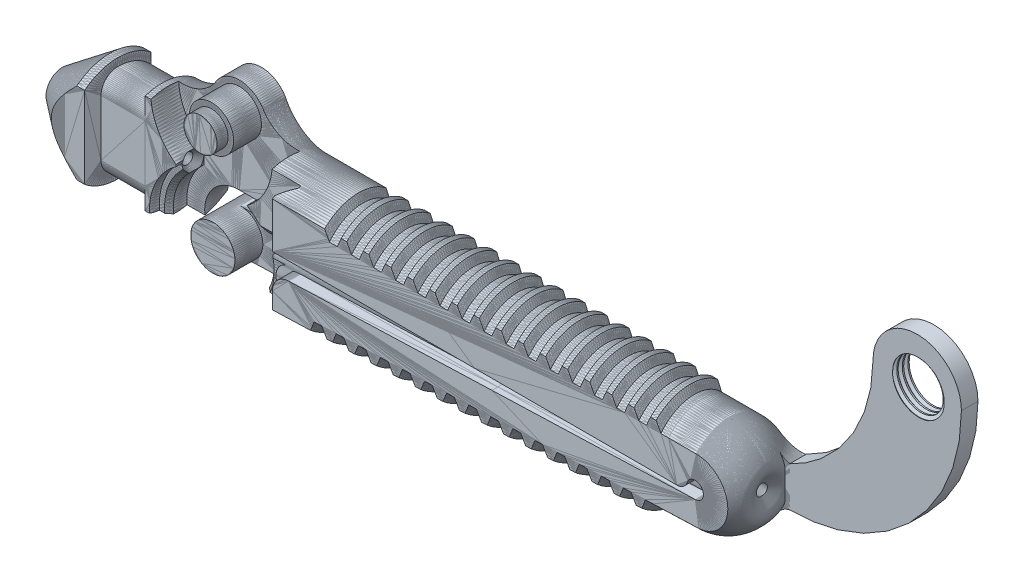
SolidWorks part; units mm, degrees
ref_plane "Front Plane" through (0, 0, 0) normal (0, 0, 1) x (1, 0, 0)
ref_plane "Top Plane" through (0, 0, 0) normal (0, 1, 0) x (1, 0, 0)
ref_plane "Right Plane" through (0, 0, 0) normal (1, 0, 0) x (0, 0, -1)
imported_body "Imported1"
sketch "Sketch1" plane through (0, 0, 0) normal (0, 0, 1) x (1, 0, 0)
  line L1 (144.0528, 112.3031) -> (178.4911, 112.3031)
  line L2 (144.0528, 112.3031) -> (144.0528, 73.8316)
  line L3 (144.0528, 73.8316) -> (178.4911, 73.8316)
  line L4 (178.4911, 112.3031) -> (178.4911, 73.8316)
extrude "Cut-Extrude1" cut sketch "Sketch1" against normal through all and the other way through all
sketch "Sketch2" plane through (0, 0, 0) normal (0, 0, 1) x (1, 0, 0)
  line L1 (135.9411, 85.8268) -> (211.3676, 85.8268) construction
  line L5 (144.0528, 89.4694) -> (144.0528, 82.2365)
  arc A0 (175.1431, 113.3268) -> (159.1431, 113.3268) centre (167.1431, 113.3268) ccw
  circle A1 centre (167.1431, 113.3268) radius 27.5 construction
  circle A2 centre (135.9411, 85.8268) radius 1.5004 construction
  arc A3 (144.0528, 82.2365) -> (175.1431, 113.3268) centre (144.0528, 113.3268) ccw
  arc A4 (144.0528, 89.4694) -> (159.1431, 113.3268) centre (132.7389, 113.3268) ccw
  dimension "D1" = 16
  dimension "D2" = 55
extrude "Boss-Extrude2" add sketch "Sketch2" along normal up to surface (3.0011 mm away)
sketch "Sketch6" plane through (-0.0001, 0.0002, 3.0041) normal (0, 0.0001, 1) x (1, 0, 0)
  line L0 (167.1432, 113.3264) -> (167.1429, 113.3272) construction
  circle A0 centre (167.1431, 113.3266) radius 4.45
  ellipse E0 centre (167.1431, 113.3266) end of major axis (164.6337, 120.9228) minor radius 8 (175.1431, 113.3266) -> (159.1431, 113.3266) ccw construction
  dimension "D1" = 8.9
extrude "Cut-Extrude2" cut sketch "Sketch6" against normal blind 10
thread "Thread1" pitch 1 start angle 0, offset 5, length 10, pitch 1, diameter 8.9
ref_plane "Plane2" through (162.6929, 113.3271, 7.9999) normal (0, -1, 0.0001) x (-1, 0, 0)
sketch "Thread Profile1" plane through (162.6929, 113.3271, 7.9999) normal (0, -1, 0.0001) x (-1, 0, 0)
  line L0 (0, 0) -> (0, 1) construction
  line L1 (0, 0) -> (0.5413, 0.3125)
  line L2 (0.5413, 0.3125) -> (0.5413, 0.4375)
  line L3 (0.5413, 0.4375) -> (0, 0.75)
  line L4 (0.5413, 0.375) -> (0, 0.375) construction
  line L11 (0, 0) -> (0, 0.75)
  point P2 (0, 0)
  dimension "Pitch" = 1
  dimension "Profile_Angle" = 60
  dimension "Profile_Land" = 0.125
  dimension "Profile_Height" = 0.5413
sketch "Sketch3" plane through (-0.0001, 0.0002, 3.0041) normal (0, 0.0001, 1) x (1, 0, 0)
  line L0 (165.6432, 113.3264) -> (165.6429, 113.3273) construction
  circle A0 centre (165.6431, 113.3266) radius 9.5
  circle A1 centre (165.6431, 113.3266) radius 6
  ellipse E1 centre (165.6431, 113.3266) end of major axis (162.6632, 122.3471) minor radius 9.5 (175.1431, 113.3266) -> (156.1431, 113.3266) ccw construction
  dimension "D1" = 19
  dimension "D2" = 12
extrude "Boss-Extrude3" add sketch "Sketch3" along normal blind 32
ref_plane "Plane1" through (165.6431, 0, 0.0039) normal (-1, 0, 0) x (0, -0.0001, -1)
sketch "Sketch5" plane through (165.6431, 0, 0.0039) normal (-1, 0, 0) x (0, -0.0001, -1)
  line L0 (-3.0041, -103.8266) -> (-35.0041, -103.8266) construction
  line L1 (-34.0041, -103.8266) -> (-32.0041, -103.8266)
  line L2 (-34.0041, -103.8266) -> (-34.0041, -105.8266)
  line L3 (-34.0041, -105.8266) -> (-32.0041, -105.8266)
  line L4 (-32.0041, -103.8266) -> (-32.0041, -105.8266)
  line L7 (-3.0041, -103.8266) -> (-3.0041, -113.3266) construction
  line L8 (-35.0041, -113.3266) -> (-3.0041, -113.3266) construction
  dimension "D1" = 7.5
  dimension "D2" = 29
  dimension "D3" = 2
revolve "Cut-Revolve1" cut sketch "Sketch5" angle 360
